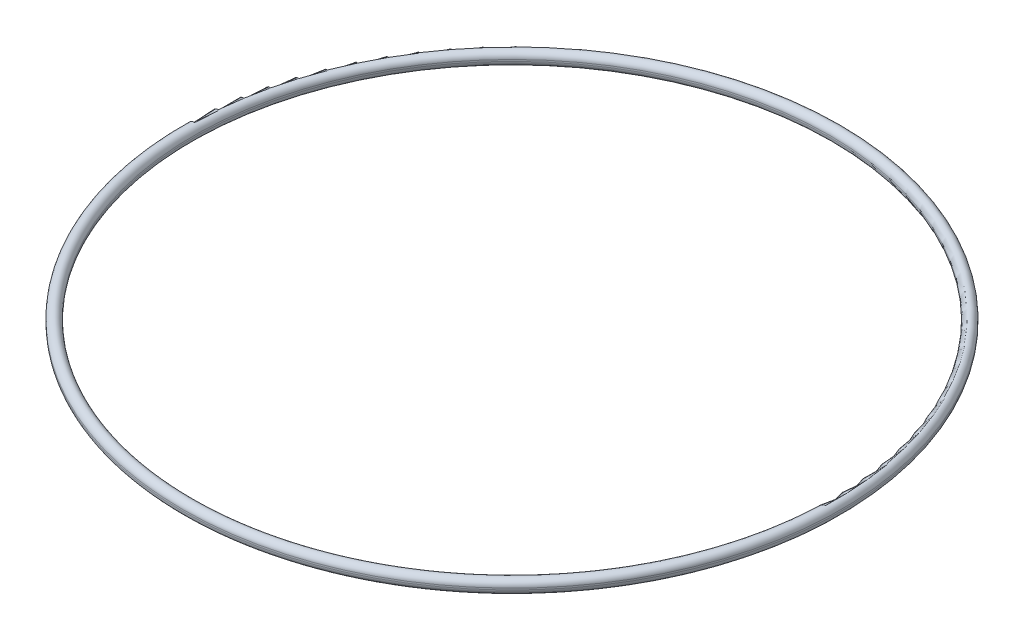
SolidWorks part; units mm, degrees
ref_plane "Front Plane" through (0, 0, 0) normal (0, 0, 1) x (1, 0, 0)
ref_plane "Top Plane" through (0, 0, 0) normal (0, 1, 0) x (1, 0, 0)
ref_plane "Right Plane" through (0, 0, 0) normal (1, 0, 0) x (0, 0, -1)
sketch "Sketch1" plane through (0, 0, 0) normal (0, 0, 1) x (1, 0, 0)
  line L0 (0, 0) -> (0, 82.4318) construction
  line L1 (36.9094, 0) -> (36.9094, 0.1905)
  line L2 (38.2587, 0.1905) -> (38.2587, 0)
  arc A0 (36.9094, 0.1905) -> (38.2587, 0.1905) centre (37.5841, 0.1905) cw
  arc A1 (38.2587, 0) -> (36.9094, 0) centre (37.5841, 0) cw
  dimension "D1" = 73.8188
  dimension "D2" = 76.5175
  dimension "D3" = 0.1905
revolve "Revolve1" add sketch "Sketch1" angle 360 about L0
